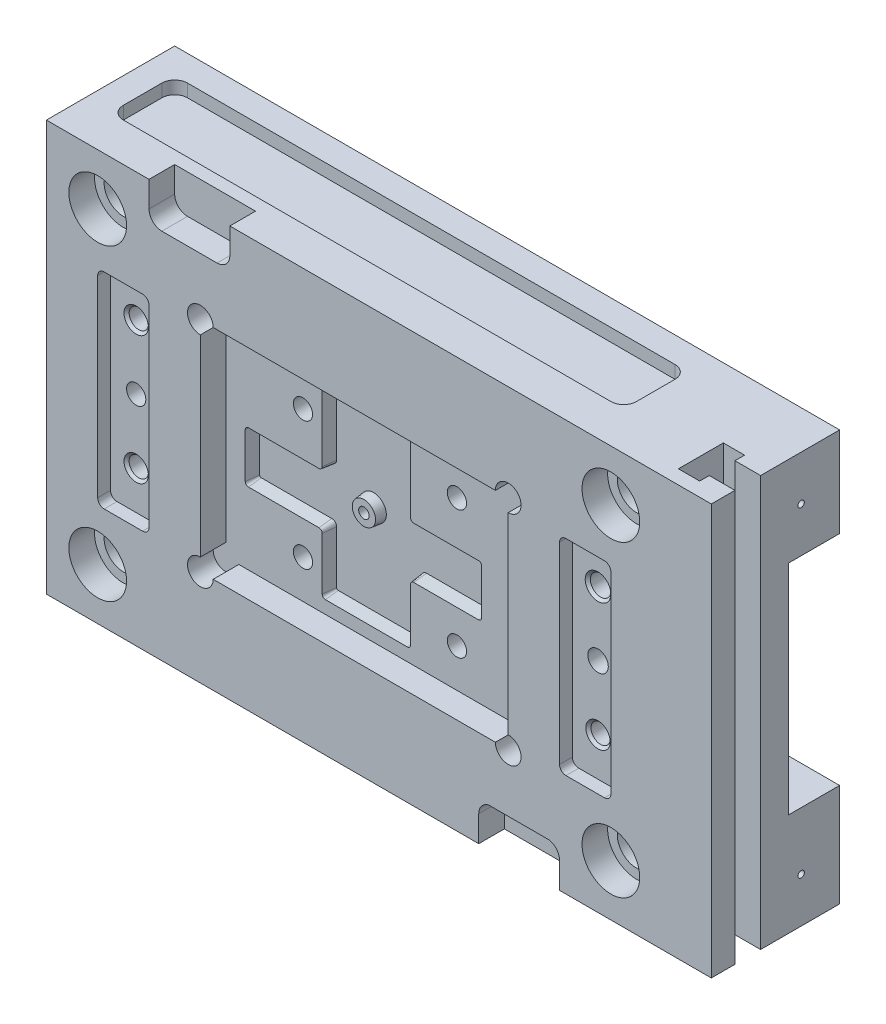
SolidWorks part; units mm, degrees
ref_plane "Plane1" through (0, 0, 0) normal (0, 0, 1) x (1, 0, 0)
ref_plane "Plane2" through (0, 0, 0) normal (0, 1, 0) x (1, 0, 0)
ref_plane "Plane3" through (0, 0, 0) normal (1, 0, 0) x (0, 0, -1)
ref_plane "Plane4" through (0, 0, -127) normal (0, 0, -1) x (-1, 0, 0)
sketch "Sketch1" plane through (0, 0, -127) normal (0, 0, -1) x (-1, 0, 0)
  line L0 (-658.2561, 0) -> (0, 0)
  line L1 (0, 0) -> (0, 406.4)
  line L2 (0, 406.4) -> (-658.2561, 406.4)
  line L3 (-658.2561, 406.4) -> (-658.2561, 0)
extrude "Base-Extrude" add sketch "Sketch1" against normal blind 127
sketch "Sketch2" plane through (658.2561, 0, 0) normal (1, 0, 0) x (0, 0, -1)
  line L0 (127, 101.6) -> (127, 317.5)
  line L1 (127, 317.5) -> (76.2, 317.5)
  line L2 (76.2, 317.5) -> (76.2, 101.6)
  line L3 (76.2, 101.6) -> (127, 101.6)
extrude "Cut-Extrude1" cut sketch "Sketch2" against normal up to next
hole_wizard "Hole1" positions "Sketch4" profile "Sketch3" legacy
sketch "Sketch4" plane through (0, 0, 0) normal (0, 0, 1) x (1, 0, 0)
  point P0 (50.8, 355.6)
sketch "Sketch3" plane through (50.8, 355.6, 0) normal (1, 0, 0) x (0, -1, 0)
  line L0 (0, 0) -> (0, 127)
  line L1 (0, 127) -> (19.05, 127)
  line L2 (19.05, 127) -> (19.05, 25.4)
  line L3 (19.05, 25.4) -> (28.575, 25.4)
  line L4 (28.575, 25.4) -> (28.575, 0)
  line L5 (28.575, 0) -> (0, 0)
  line L6 (0, 110) -> (0, -10) construction
  dimension "Diameter" = 38.1
  dimension "Depth" = 127
  dimension "C.Bore Ø" = 57.15
  dimension "Bore Depth" = 25.4
hole_wizard "Hole2" positions "Sketch6" profile "Sketch5" legacy
sketch "Sketch6" plane through (0, 0, 0) normal (0, 0, 1) x (1, 0, 0)
  point P0 (558.8, 355.6)
sketch "Sketch5" plane through (558.8, 355.6, 0) normal (1, 0, 0) x (0, -1, 0)
  line L0 (0, 0) -> (0, 127)
  line L1 (0, 127) -> (19.05, 127)
  line L2 (19.05, 127) -> (19.05, 25.4)
  line L3 (19.05, 25.4) -> (28.575, 25.4)
  line L4 (28.575, 25.4) -> (28.575, 0)
  line L5 (28.575, 0) -> (0, 0)
  line L6 (0, 110) -> (0, -10) construction
  dimension "Diameter" = 38.1
  dimension "Depth" = 127
  dimension "C.Bore Ø" = 57.15
  dimension "Bore Depth" = 25.4
hole_wizard "Hole3" positions "Sketch8" profile "Sketch7" legacy
sketch "Sketch8" plane through (0, 0, 0) normal (0, 0, 1) x (1, 0, 0)
  point P0 (50.8, 50.8)
sketch "Sketch7" plane through (50.8, 50.8, 0) normal (1, 0, 0) x (0, -1, 0)
  line L0 (0, 0) -> (0, 127)
  line L1 (0, 127) -> (19.05, 127)
  line L2 (19.05, 127) -> (19.05, 25.4)
  line L3 (19.05, 25.4) -> (28.575, 25.4)
  line L4 (28.575, 25.4) -> (28.575, 0)
  line L5 (28.575, 0) -> (0, 0)
  line L6 (0, 110) -> (0, -10) construction
  dimension "Diameter" = 38.1
  dimension "Depth" = 127
  dimension "C.Bore Ø" = 57.15
  dimension "Bore Depth" = 25.4
hole_wizard "Hole4" positions "Sketch10" profile "Sketch9" legacy
sketch "Sketch10" plane through (0, 0, 0) normal (0, 0, 1) x (1, 0, 0)
  point P0 (558.8, 50.8)
sketch "Sketch9" plane through (558.8, 50.8, 0) normal (1, 0, 0) x (0, -1, 0)
  line L0 (0, 0) -> (0, 127)
  line L1 (0, 127) -> (19.05, 127)
  line L2 (19.05, 127) -> (19.05, 25.4)
  line L3 (19.05, 25.4) -> (28.575, 25.4)
  line L4 (28.575, 25.4) -> (28.575, 0)
  line L5 (28.575, 0) -> (0, 0)
  line L6 (0, 110) -> (0, -10) construction
  dimension "Diameter" = 38.1
  dimension "Depth" = 127
  dimension "C.Bore Ø" = 57.15
  dimension "Bore Depth" = 25.4
sketch "Sketch11" plane through (0, 0, 0) normal (0, 0, 1) x (1, 0, 0)
  line L0 (50.8, 101.6) -> (101.6, 101.6)
  line L1 (101.6, 101.6) -> (101.6, 304.8)
  line L2 (101.6, 304.8) -> (50.8, 304.8)
  line L3 (50.8, 304.8) -> (50.8, 101.6)
extrude "Cut-Extrude2" cut sketch "Sketch11" against normal blind 12.7
sketch "Sketch12" plane through (0, 0, -76.2) normal (0, 0, -1) x (-1, 0, 0)
  circle A0 centre (-76.2, 139.7) radius 12.065
extrude "Cut-Extrude3" cut sketch "Sketch12" against normal blind 2.54 draft 45
sketch "Sketch13" plane through (0, 0, -73.66) normal (0, 0, -1) x (-1, 0, 0)
  circle A0 centre (-76.2, 139.7) radius 9.525
extrude "Cut-Extrude4" cut sketch "Sketch13" against normal blind 58.42
sketch "Sketch14" plane through (0, 0, -12.7) normal (0, 0, 1) x (1, 0, 0)
  circle A0 centre (76.2, 139.7) radius 12.065
extrude "Cut-Extrude5" cut sketch "Sketch14" against normal blind 2.54 draft 45
sketch "Sketch15" plane through (0, 0, -12.7) normal (0, 0, 1) x (1, 0, 0)
  circle A0 centre (76.2, 266.7) radius 12.065
extrude "Cut-Extrude6" cut sketch "Sketch15" against normal blind 2.54 draft 45
sketch "Sketch16" plane through (0, 0, -15.24) normal (0, 0, 1) x (1, 0, 0)
  circle A0 centre (76.2, 266.7) radius 9.525
extrude "Cut-Extrude7" cut sketch "Sketch16" against normal blind 58.42
sketch "Sketch17" plane through (0, 0, -76.2) normal (0, 0, -1) x (-1, 0, 0)
  circle A0 centre (-76.2, 266.7) radius 12.065
extrude "Cut-Extrude8" cut sketch "Sketch17" against normal blind 2.54 draft 45
other "Hole5" parameters "D1"=63.5, "D2"=0, "D3"=0, "D4"=0
sketch "Sketch18" plane through (0, 0, -76.2) normal (0, 0, -1) x (-1, 0, 0)
  circle A0 centre (-76.2, 203.2) radius 9.525
  dimension "D1" = 19.05
sketch "Sketch19" plane through (0, 0, 0) normal (0, 0, 1) x (1, 0, 0)
  line L0 (508, 101.6) -> (558.8, 101.6)
  line L1 (558.8, 101.6) -> (558.8, 304.8)
  line L2 (558.8, 304.8) -> (508, 304.8)
  line L3 (508, 304.8) -> (508, 101.6)
extrude "Cut-Extrude9" cut sketch "Sketch19" against normal blind 12.7
sketch "Sketch20" plane through (0, 0, -76.2) normal (0, 0, -1) x (-1, 0, 0)
  circle A0 centre (-533.4, 139.7) radius 12.065
extrude "Cut-Extrude10" cut sketch "Sketch20" against normal blind 2.54 draft 45
sketch "Sketch21" plane through (0, 0, -73.66) normal (0, 0, -1) x (-1, 0, 0)
  circle A0 centre (-533.4, 139.7) radius 9.525
extrude "Cut-Extrude11" cut sketch "Sketch21" against normal blind 58.42
sketch "Sketch22" plane through (0, 0, -12.7) normal (0, 0, 1) x (1, 0, 0)
  circle A0 centre (533.4, 139.7) radius 12.065
extrude "Cut-Extrude12" cut sketch "Sketch22" against normal blind 2.54 draft 45
sketch "Sketch23" plane through (0, 0, -76.2) normal (0, 0, -1) x (-1, 0, 0)
  circle A0 centre (-533.4, 266.7) radius 12.6862
extrude "Cut-Extrude13" cut sketch "Sketch23" against normal blind 2.54 draft 45
sketch "Sketch24" plane through (0, 0, -73.66) normal (0, 0, -1) x (-1, 0, 0)
  circle A0 centre (-533.4, 266.7) radius 10.1462
extrude "Cut-Extrude14" cut sketch "Sketch24" against normal blind 58.42
sketch "Sketch25" plane through (0, 0, -12.7) normal (0, 0, 1) x (1, 0, 0)
  circle A0 centre (533.4, 266.7) radius 12.6862
extrude "Cut-Extrude15" cut sketch "Sketch25" against normal blind 2.54 draft 45
other "Hole6" parameters "D1"=63.5, "D2"=0, "D3"=0, "D4"=0
sketch "Sketch26" plane through (0, 0, -76.2) normal (0, 0, -1) x (-1, 0, 0)
  circle A0 centre (-533.4, 203.2) radius 10.1462
  dimension "D1" = 20.2923
sketch "Sketch27" plane through (0, 0, 0) normal (0, 0, 1) x (1, 0, 0)
  line L0 (165.1, 95.25) -> (444.5, 95.25)
  line L1 (457.2, 107.95) -> (457.2, 298.45)
  line L2 (444.5, 311.15) -> (165.1, 311.15)
  line L3 (152.4, 298.45) -> (152.4, 107.95)
  arc A0 (444.5, 95.25) -> (457.2, 107.95) centre (457.2, 95.25) ccw
  arc A1 (457.2, 298.45) -> (444.5, 311.15) centre (457.2, 311.15) ccw
  arc A2 (165.1, 311.15) -> (152.4, 298.45) centre (152.4, 311.15) ccw
  arc A3 (152.4, 107.95) -> (165.1, 95.25) centre (152.4, 95.25) ccw
extrude "Cut-Extrude16" cut sketch "Sketch27" against normal blind 25.4
hole_wizard "Hole7" positions "Sketch29" profile "Sketch28" legacy
sketch "Sketch29" plane through (0, 0, -76.2) normal (0, 0, -1) x (-1, 0, 0)
  point P0 (-381, 260.35)
sketch "Sketch28" plane through (381, 260.35, -76.2) normal (1, 0, 0) x (0, 1, 0)
  line L0 (0, 0) -> (0, 50.8)
  line L1 (0, 50.8) -> (9.525, 50.8)
  line L2 (9.525, 50.8) -> (9.525, 12.7)
  line L3 (9.525, 12.7) -> (22.225, 12.7)
  line L4 (22.225, 12.7) -> (22.225, 0)
  line L5 (22.225, 0) -> (0, 0)
  line L6 (0, 110) -> (0, -10) construction
  dimension "Diameter" = 19.05
  dimension "Depth" = 50.8
  dimension "C.Bore Ø" = 44.45
  dimension "Bore Depth" = 12.7
hole_wizard "Hole8" positions "Sketch31" profile "Sketch30" legacy
sketch "Sketch31" plane through (0, 0, -76.2) normal (0, 0, -1) x (-1, 0, 0)
  point P0 (-381, 133.35)
sketch "Sketch30" plane through (381, 133.35, -76.2) normal (1, 0, 0) x (0, 1, 0)
  line L0 (0, 0) -> (0, 50.8)
  line L1 (0, 50.8) -> (9.525, 50.8)
  line L2 (9.525, 50.8) -> (9.525, 12.7)
  line L3 (9.525, 12.7) -> (22.225, 12.7)
  line L4 (22.225, 12.7) -> (22.225, 0)
  line L5 (22.225, 0) -> (0, 0)
  line L6 (0, 110) -> (0, -10) construction
  dimension "Diameter" = 19.05
  dimension "Depth" = 50.8
  dimension "C.Bore Ø" = 44.45
  dimension "Bore Depth" = 12.7
hole_wizard "Hole9" positions "Sketch33" profile "Sketch32" legacy
sketch "Sketch33" plane through (0, 0, -76.2) normal (0, 0, -1) x (-1, 0, 0)
  point P0 (-228.6, 133.35)
sketch "Sketch32" plane through (228.6, 133.35, -76.2) normal (1, 0, 0) x (0, 1, 0)
  line L0 (0, 0) -> (0, 50.8)
  line L1 (0, 50.8) -> (9.525, 50.8)
  line L2 (9.525, 50.8) -> (9.525, 12.7)
  line L3 (9.525, 12.7) -> (22.225, 12.7)
  line L4 (22.225, 12.7) -> (22.225, 0)
  line L5 (22.225, 0) -> (0, 0)
  line L6 (0, 110) -> (0, -10) construction
  dimension "Diameter" = 19.05
  dimension "Depth" = 50.8
  dimension "C.Bore Ø" = 44.45
  dimension "Bore Depth" = 12.7
hole_wizard "Hole10" positions "Sketch35" profile "Sketch34" legacy
sketch "Sketch35" plane through (0, 0, -76.2) normal (0, 0, -1) x (-1, 0, 0)
  point P0 (-228.6, 260.35)
sketch "Sketch34" plane through (228.6, 260.35, -76.2) normal (1, 0, 0) x (0, 1, 0)
  line L0 (0, 0) -> (0, 50.8)
  line L1 (0, 50.8) -> (9.525, 50.8)
  line L2 (9.525, 50.8) -> (9.525, 12.7)
  line L3 (9.525, 12.7) -> (22.225, 12.7)
  line L4 (22.225, 12.7) -> (22.225, 0)
  line L5 (22.225, 0) -> (0, 0)
  line L6 (0, 110) -> (0, -10) construction
  dimension "Diameter" = 19.05
  dimension "Depth" = 50.8
  dimension "C.Bore Ø" = 44.45
  dimension "Bore Depth" = 12.7
sketch "Sketch36" plane through (0, 0, -25.4) normal (0, 0, 1) x (1, 0, 0)
  line L0 (247.65, 288.925) -> (247.65, 220.401)
  line L1 (244.475, 217.226) -> (174.625, 217.226)
  line L2 (171.45, 214.051) -> (171.45, 169.601)
  line L3 (174.625, 166.426) -> (244.475, 166.426)
  line L4 (247.65, 163.251) -> (247.65, 111.125)
  line L5 (250.825, 107.95) -> (331.9096, 107.95)
  line L6 (335.0846, 111.125) -> (335.0846, 163.251)
  line L7 (338.2596, 166.426) -> (402.3524, 166.426)
  line L8 (405.5274, 169.601) -> (405.5274, 214.051)
  line L9 (402.3524, 217.226) -> (338.2596, 217.226)
  line L10 (335.0846, 220.401) -> (335.0846, 288.925)
  line L11 (331.9096, 292.1) -> (250.825, 292.1)
  arc A0 (247.65, 220.401) -> (244.475, 217.226) centre (244.475, 220.401) cw
  arc A1 (174.625, 217.226) -> (171.45, 214.051) centre (174.625, 214.051) ccw
  arc A2 (171.45, 169.601) -> (174.625, 166.426) centre (174.625, 169.601) ccw
  arc A3 (244.475, 166.426) -> (247.65, 163.251) centre (244.475, 163.251) cw
  arc A4 (247.65, 111.125) -> (250.825, 107.95) centre (250.825, 111.125) ccw
  arc A5 (331.9096, 107.95) -> (335.0846, 111.125) centre (331.9096, 111.125) ccw
  arc A6 (335.0846, 163.251) -> (338.2596, 166.426) centre (338.2596, 163.251) cw
  arc A7 (402.3524, 166.426) -> (405.5274, 169.601) centre (402.3524, 169.601) ccw
  arc A8 (405.5274, 214.051) -> (402.3524, 217.226) centre (402.3524, 214.051) ccw
  arc A9 (338.2596, 217.226) -> (335.0846, 220.401) centre (338.2596, 220.401) cw
  arc A10 (335.0846, 288.925) -> (331.9096, 292.1) centre (331.9096, 288.925) ccw
  arc A11 (250.825, 292.1) -> (247.65, 288.925) centre (250.825, 288.925) ccw
extrude "Cut-Extrude17" cut sketch "Sketch36" against normal blind 12.7 draft 7
sketch "Sketch37" plane through (0, 0, -38.1) normal (0, 0, 1) x (1, 0, 0)
  circle A0 centre (285.75, 198.176) radius 12.7
extrude "Boss-Extrude1" add sketch "Sketch37" along normal blind 9.525 draft 7
other "Hole11" parameters "D1"=47.625, "D2"=0, "D3"=0, "D4"=0
sketch "Sketch38" plane through (0, 0, -28.575) normal (0, 0, 1) x (1, 0, 0)
  circle A0 centre (285.75, 198.176) radius 5.1805
  dimension "D1" = 10.361
sketch "Sketch39" plane through (0, 0, 0) normal (0, 0, 1) x (1, 0, 0)
  line L0 (428, 25.6903) -> (428, 0)
  line L1 (428, 0) -> (508, 0)
  line L2 (508, 0) -> (508, 25.6903)
  line L3 (498, 38.1) -> (438, 38.1)
  arc A0 (508, 25.6903) -> (498, 38.1) centre (495.3, 25.6903) ccw
  arc A1 (438, 38.1) -> (428, 25.6903) centre (440.7, 25.6903) ccw
extrude "Cut-Extrude18" cut sketch "Sketch39" against normal blind 25.4
sketch "Sketch40" plane through (0, 406.4, 0) normal (0, 1, 0) x (-1, 0, 0)
  line L0 (-181.6, 0) -> (-181.6, -25.4)
  line L1 (-181.6, -25.4) -> (-101.6, -25.4)
  line L2 (-101.6, -25.4) -> (-101.6, 0)
  line L3 (-101.6, 0) -> (-181.6, 0)
extrude "Cut-Extrude19" cut sketch "Sketch40" against normal blind 38.1
sketch "Sketch41" plane through (0, 0, 0) normal (-1, 0, 0) x (0, 0, 1)
  line L0 (-12.7, 19.05) -> (-12.7, 387.35)
  line L1 (-19.05, 393.7) -> (-107.95, 393.7)
  line L2 (-114.3, 387.35) -> (-114.3, 336.55)
  line L3 (-107.95, 330.2) -> (-69.85, 330.2)
  line L4 (-63.5, 323.85) -> (-63.5, 95.25)
  line L5 (-69.85, 88.9) -> (-107.95, 88.9)
  line L6 (-114.3, 82.55) -> (-114.3, 19.05)
  line L7 (-107.95, 12.7) -> (-19.05, 12.7)
  arc A0 (-12.7, 387.35) -> (-19.05, 393.7) centre (-19.05, 387.35) ccw
  arc A1 (-107.95, 393.7) -> (-114.3, 387.35) centre (-107.95, 387.35) ccw
  arc A2 (-114.3, 336.55) -> (-107.95, 330.2) centre (-107.95, 336.55) ccw
  arc A3 (-69.85, 330.2) -> (-63.5, 323.85) centre (-69.85, 323.85) cw
  arc A4 (-63.5, 95.25) -> (-69.85, 88.9) centre (-69.85, 95.25) cw
  arc A5 (-107.95, 88.9) -> (-114.3, 82.55) centre (-107.95, 82.55) ccw
  arc A6 (-114.3, 19.05) -> (-107.95, 12.7) centre (-107.95, 19.05) ccw
  arc A7 (-19.05, 12.7) -> (-12.7, 19.05) centre (-19.05, 19.05) ccw
extrude "Cut-Extrude20" cut sketch "Sketch41" against normal blind 15.7634 draft 7
sketch "Sketch42" plane through (0, 0, 0) normal (0, -1, 0) x (1, 0, 0)
  line L0 (25.4, -38.1) -> (25.4, -101.6)
  line L1 (25.4, -101.6) -> (533.4, -101.6)
  line L2 (533.4, -101.6) -> (533.4, -38.1)
  line L3 (533.4, -38.1) -> (25.4, -38.1)
  line L4 (0, 0) -> (0, -127) construction
  line L5 (658.2561, -127) -> (0, -127) construction
  dimension "D1" = 508
  dimension "D2" = 25.4
  dimension "D3" = 25.4
  dimension "D4" = 63.5
extrude "Cut-Extrude21" cut sketch "Sketch42" against normal blind 12.7
sketch "Sketch43" plane through (0, 406.4, 0) normal (0, 1, 0) x (-1, 0, 0)
  line L0 (-25.4, -38.1) -> (-533.4, -38.1)
  line L1 (-533.4, -38.1) -> (-533.4, -101.6)
  line L2 (-533.4, -101.6) -> (-25.4, -101.6)
  line L3 (-25.4, -101.6) -> (-25.4, -38.1)
  line L4 (0, 0) -> (0, -127) construction
  line L5 (0, -127) -> (-658.2561, -127) construction
  dimension "D1" = 25.4
  dimension "D2" = 508
  dimension "D3" = 25.4
  dimension "D4" = 63.5
extrude "Cut-Extrude22" cut sketch "Sketch43" against normal blind 12.7
fillet "Fillet1" radius 6.35
fillet "Fillet2" radius 6.35
fillet "Fillet3" radius 6.35
fillet "Fillet4" radius 6.35
fillet "Fillet5" radius 6.35
fillet "Fillet6" radius 6.35
fillet "Fillet7" radius 6.35
fillet "Fillet8" radius 6.35
fillet "Fillet9" radius 12.7
fillet "Fillet10" radius 12.7
fillet "Fillet11" radius 12.7
fillet "Fillet12" radius 12.7
fillet "Fillet13" radius 12.7
fillet "Fillet14" radius 12.7
fillet "Fillet15" radius 12.7
fillet "Fillet16" radius 12.7
fillet "Fillet17" radius 12.7
fillet "Fillet18" radius 12.7
sketch "Sketch48" plane through (0, 0, 0) normal (0, -1, 0) x (1, 0, 0)
  line L0 (632.8561, -48.7717) -> (632.8561, -58.2967)
  line L1 (670.9561, -23.3717) -> (632.8561, -23.3717)
  line L2 (670.9561, -23.3717) -> (670.9561, -48.7717)
  line L3 (670.9561, -48.7717) -> (632.8561, -48.7717)
  line L4 (658.2561, 0) -> (658.2561, -127) construction
  line L5 (632.8561, -13.8467) -> (611.8218, -13.8467)
  line L6 (632.8561, -13.8467) -> (632.8561, -23.3717)
  line L7 (632.8561, -58.2967) -> (611.8218, -58.2967)
  line L8 (611.8218, -13.8467) -> (611.8218, -58.2967)
  dimension "D1" = 9.525
  dimension "D2" = 25.4
  dimension "D3" = 9.525
  dimension "D4" = 21.0344
  dimension "D5" = 25.4
  dimension "D7" = 12.7
extrude "Cut-Extrude23" cut sketch "Sketch48" against normal through all
hole_wizard "Hole14" positions "Sketch55" profile "Sketch54" legacy
sketch "Sketch55" plane through (658.2561, 0, 0) normal (1, 0, 0) x (0, 0, -1)
  line L0 (127, 101.6) -> (127, 0) construction
  line L1 (48.7717, 0) -> (127, 0) construction
  point P0 (88.9, 44.45)
  dimension "D1" = 38.1
  dimension "D2" = 44.45
sketch "Sketch54" plane through (658.2561, 44.45, -88.9) normal (0, 1, 0) x (0, 0, -1)
  line L0 (0, 0) -> (0, 5.08)
  line L1 (0, 5.08) -> (3.175, 5.08)
  line L2 (3.175, 5.08) -> (3.175, 0)
  line L3 (3.175, 0) -> (0, 0)
  line L4 (0, 110) -> (0, -10) construction
  dimension "Diameter" = 6.35
  dimension "Depth" = 5.08
hole_wizard "Hole15" positions "Sketch57" profile "Sketch56" legacy
sketch "Sketch57" plane through (658.2561, 0, 0) normal (1, 0, 0) x (0, 0, -1)
  line L0 (48.7717, 406.4) -> (127, 406.4) construction
  line L1 (127, 406.4) -> (127, 317.5) construction
  point P0 (88.9, 361.95)
  dimension "D1" = 44.45
  dimension "D2" = 38.1
sketch "Sketch56" plane through (658.2561, 361.95, -88.9) normal (0, 1, 0) x (0, 0, -1)
  line L0 (0, 0) -> (0, 5.08)
  line L1 (0, 5.08) -> (3.175, 5.08)
  line L2 (3.175, 5.08) -> (3.175, 0)
  line L3 (3.175, 0) -> (0, 0)
  line L4 (0, 110) -> (0, -10) construction
  dimension "Diameter" = 6.35
  dimension "Depth" = 5.08
sketch "Avoid Area" plane through (0, 0, 0) normal (0, 0, 1) x (1, 0, 0)
  line L12 (331.9096, 292.1) -> (250.825, 292.1)
  line L13 (247.65, 288.925) -> (247.65, 220.401)
  line L14 (244.475, 217.226) -> (174.625, 217.226)
  line L15 (171.45, 214.051) -> (171.45, 169.601)
  line L16 (174.625, 166.426) -> (244.475, 166.426)
  line L17 (247.65, 163.251) -> (247.65, 111.125)
  line L18 (250.825, 107.95) -> (331.9096, 107.95)
  line L19 (335.0846, 111.125) -> (335.0846, 163.251)
  line L20 (338.2596, 166.426) -> (402.3524, 166.426)
  line L21 (405.5274, 169.601) -> (405.5274, 214.051)
  line L22 (402.3524, 217.226) -> (338.2596, 217.226)
  line L23 (335.0846, 220.401) -> (335.0846, 288.925)
  line L24 (331.9096, 292.1) -> (250.825, 292.1)
  line L25 (247.65, 288.925) -> (247.65, 220.401)
  line L26 (244.475, 217.226) -> (174.625, 217.226)
  line L27 (171.45, 214.051) -> (171.45, 169.601)
  line L28 (174.625, 166.426) -> (244.475, 166.426)
  line L29 (247.65, 163.251) -> (247.65, 111.125)
  line L30 (250.825, 107.95) -> (331.9096, 107.95)
  line L31 (335.0846, 111.125) -> (335.0846, 163.251)
  line L32 (338.2596, 166.426) -> (402.3524, 166.426)
  line L33 (405.5274, 169.601) -> (405.5274, 214.051)
  line L34 (402.3524, 217.226) -> (338.2596, 217.226)
  line L35 (335.0846, 220.401) -> (335.0846, 288.925)
  arc A12 (250.825, 292.1) -> (247.65, 288.925) centre (250.825, 288.925) ccw
  arc A13 (244.475, 217.226) -> (247.65, 220.401) centre (244.475, 220.401) ccw
  arc A14 (174.625, 217.226) -> (171.45, 214.051) centre (174.625, 214.051) ccw
  arc A15 (171.45, 169.601) -> (174.625, 166.426) centre (174.625, 169.601) ccw
  arc A16 (247.65, 163.251) -> (244.475, 166.426) centre (244.475, 163.251) ccw
  arc A17 (247.65, 111.125) -> (250.825, 107.95) centre (250.825, 111.125) ccw
  arc A18 (331.9096, 107.95) -> (335.0846, 111.125) centre (331.9096, 111.125) ccw
  arc A19 (338.2596, 166.426) -> (335.0846, 163.251) centre (338.2596, 163.251) ccw
  arc A20 (402.3524, 166.426) -> (405.5274, 169.601) centre (402.3524, 169.601) ccw
  arc A21 (405.5274, 214.051) -> (402.3524, 217.226) centre (402.3524, 214.051) ccw
  arc A22 (335.0846, 220.401) -> (338.2596, 217.226) centre (338.2596, 220.401) ccw
  arc A23 (335.0846, 288.925) -> (331.9096, 292.1) centre (331.9096, 288.925) ccw
  arc A24 (250.825, 292.1) -> (247.65, 288.925) centre (250.825, 288.925) ccw
  arc A25 (244.475, 217.226) -> (247.65, 220.401) centre (244.475, 220.401) ccw
  arc A26 (174.625, 217.226) -> (171.45, 214.051) centre (174.625, 214.051) ccw
  arc A27 (171.45, 169.601) -> (174.625, 166.426) centre (174.625, 169.601) ccw
  arc A28 (247.65, 163.251) -> (244.475, 166.426) centre (244.475, 163.251) ccw
  arc A29 (247.65, 111.125) -> (250.825, 107.95) centre (250.825, 111.125) ccw
  arc A30 (331.9096, 107.95) -> (335.0846, 111.125) centre (331.9096, 111.125) ccw
  arc A31 (338.2596, 166.426) -> (335.0846, 163.251) centre (338.2596, 163.251) ccw
  arc A32 (402.3524, 166.426) -> (405.5274, 169.601) centre (402.3524, 169.601) ccw
  arc A33 (405.5274, 214.051) -> (402.3524, 217.226) centre (402.3524, 214.051) ccw
  arc A34 (335.0846, 220.401) -> (338.2596, 217.226) centre (338.2596, 220.401) ccw
  arc A35 (335.0846, 288.925) -> (331.9096, 292.1) centre (331.9096, 288.925) ccw
  dimension "D1" = 0
sketch "Slot" plane through (658.2561, 0, 0) normal (1, 0, 0) x (0, 0, -1)
  line L1 (48.7717, 0) -> (23.3717, 0) construction
  line L2 (48.7717, 0) -> (48.7717, 406.4) construction
  line L3 (48.7717, 406.4) -> (23.3717, 406.4) construction
  line L4 (23.3717, 0) -> (23.3717, 406.4) construction
